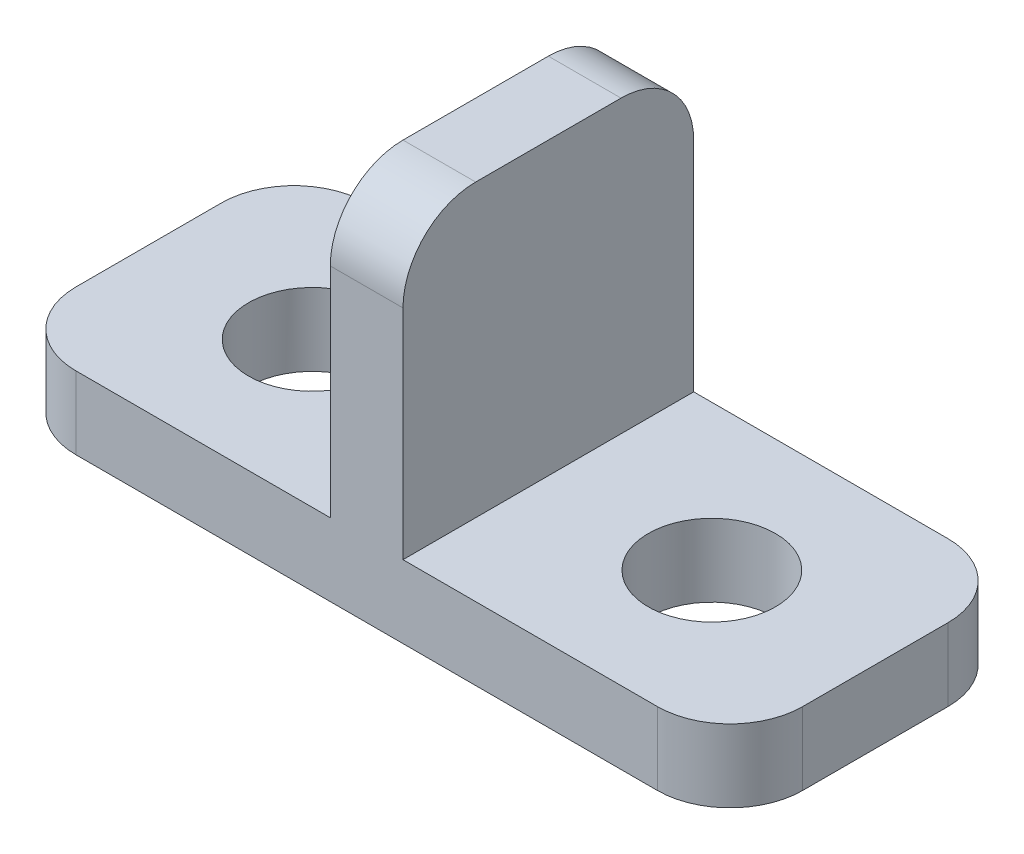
SolidWorks part; units mm, degrees
ref_plane "Спереди" through (0, 0, 0) normal (0, 0, 1) x (1, 0, 0)
ref_plane "Сверху" through (0, 0, 0) normal (0, 1, 0) x (1, 0, 0)
ref_plane "Справа" through (0, 0, 0) normal (1, 0, 0) x (0, 0, -1)
sketch "Эскиз1" plane through (0, 0, 0) normal (0, 1, 0) x (1, 0, 0)
  line L1 (-10, -4) -> (10, -4)
  line L2 (-10, -4) -> (-10, 4)
  line L3 (-10, 4) -> (10, 4)
  line L4 (10, -4) -> (10, 4)
  line L5 (-10, -4) -> (10, 4) construction
  line L6 (-10, 4) -> (10, -4) construction
  point P0 (0, 0)
  dimension "D1" = 20
  dimension "D2" = 8
extrude "Бобышка-Вытянуть1" add sketch "Эскиз1" along normal blind 2
sketch "Эскиз2" plane through (0, 2, 0) normal (0, 1, 0) x (1, 0, 0)
  line L0 (10, 4) -> (-10, 4) construction
  line L1 (-1, -4) -> (1, -4)
  line L2 (-1, -4) -> (-1, 4)
  line L3 (-1, 4) -> (1, 4)
  line L4 (1, -4) -> (1, 4)
  line L5 (-1, -4) -> (1, 4) construction
  line L6 (-1, 4) -> (1, -4) construction
  point P0 (0, 0)
  dimension "D1" = 2
extrude "Бобышка-Вытянуть2" add sketch "Эскиз2" along normal blind 8
sketch "Эскиз3" plane through (0, 2, 0) normal (0, 1, 0) x (1, 0, 0)
  line L0 (-10, 0) -> (-1, 0) construction
  line L1 (-10, 4) -> (-10, -4) construction
  line L2 (-1, 4) -> (-1, -4) construction
  line L3 (0, 0) -> (0, 7.6201) construction
  circle A0 centre (-5.5, 0) radius 1.75
  circle A1 centre (5.5, 0) radius 1.75
  dimension "D1" = 3.5
extrude "Вырез-Вытянуть1" cut sketch "Эскиз3" against normal blind 10
fillet "Скругление1" radius 2 6 edges at (0, 10, -4) (0, 10, 4) (10, 1, -4) (10, 1, 4) (-10, 1, 4) (-10, 1, -4)
